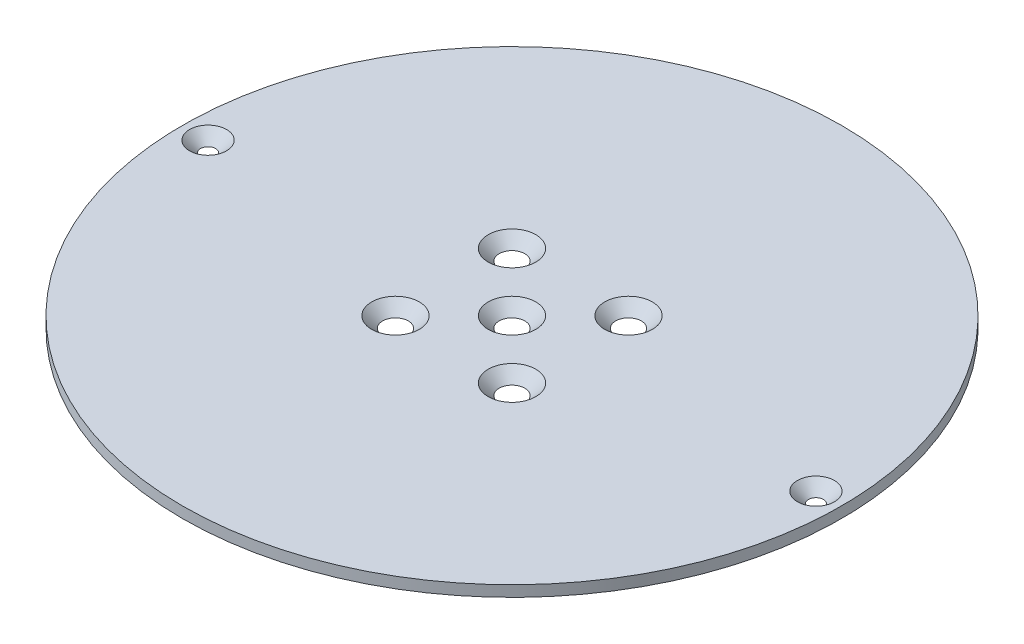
SolidWorks part; units mm, degrees
ref_plane "Plan de face" through (0, 0, 0) normal (0, 0, 1) x (1, 0, 0)
ref_plane "Plan de dessus" through (0, 0, 0) normal (0, 1, 0) x (1, 0, 0)
ref_plane "Plan de droite" through (0, 0, 0) normal (1, 0, 0) x (0, 0, -1)
sketch "Esquisse1" plane through (0, 0, 0) normal (0, 1, 0) x (1, 0, 0)
  line L0 (83, 0) -> (0, 0) construction
  line L1 (0, 0) -> (0, 90) construction
  line L3 (-15.9099, 15.9099) -> (15.9099, 15.9099) construction
  line L4 (-15.9099, 15.9099) -> (-15.9099, -15.9099) construction
  line L5 (-15.9099, -15.9099) -> (15.9099, -15.9099) construction
  line L6 (15.9099, 15.9099) -> (15.9099, -15.9099) construction
  line L7 (-15.9099, 15.9099) -> (15.9099, -15.9099) construction
  line L8 (-15.9099, -15.9099) -> (15.9099, 15.9099) construction
  circle A0 centre (0, 0) radius 90
  circle A1 centre (83, 0) radius 2.05
  circle A2 centre (-83, 0) radius 2.05
  circle A3 centre (0, 0) radius 3.5
  circle A4 centre (15.9099, 15.9099) radius 3.5
  circle A5 centre (15.9099, -15.9099) radius 3.5
  circle A6 centre (-15.9099, -15.9099) radius 3.5
  circle A7 centre (-15.9099, 15.9099) radius 3.5
  dimension "D1" = 180
  dimension "D2" = 4.1
  dimension "D5" = 7
  dimension "D3" = 83
  dimension "D4" = 22.5
extrude "Extrusion1" add sketch "Esquisse1" along normal blind 3
chamfer "Chanfrein1" distance 3 angle 45 7 edges at (83, 3, 2.05) (-83, 3, -2.05) (15.9099, 3, 19.4099) (-15.9099, 3, 19.4099) (0, 3, 3.5) (15.9099, 3, -12.4099) (-15.9099, 3, -12.4099)
